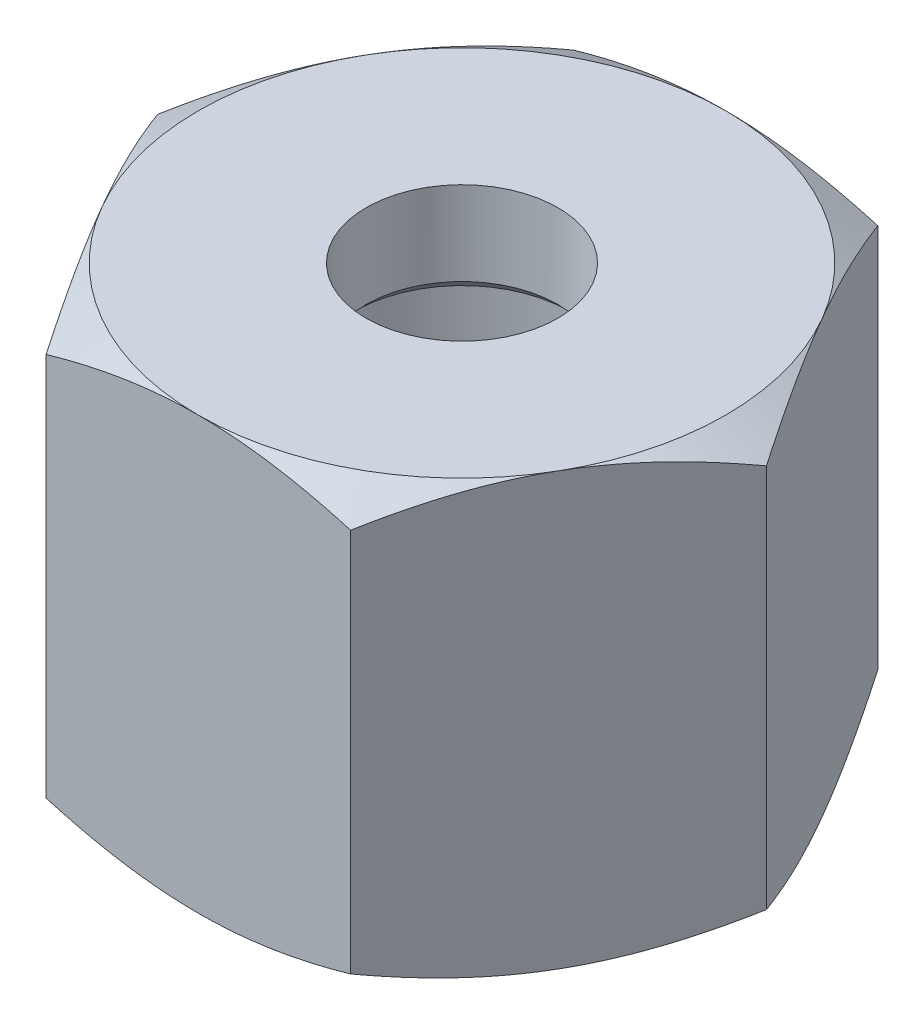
SolidWorks part; units mm, degrees
ref_plane "Přední rovina" through (0, 0, 0) normal (0, 0, 1) x (1, 0, 0)
ref_plane "Horní rovina" through (0, 0, 0) normal (0, 1, 0) x (1, 0, 0)
ref_plane "Pravá rovina" through (0, 0, 0) normal (1, 0, 0) x (0, 0, -1)
sketch "Skica1" plane through (0, 0, 0) normal (0, 1, 0) x (1, 0, 0)
  line L1 (12.7017, 0) -> (6.3509, 11)
  line L2 (6.3509, 11) -> (-6.3509, 11)
  line L3 (-6.3509, 11) -> (-12.7017, 0)
  line L4 (-12.7017, 0) -> (-6.3509, -11)
  line L5 (-6.3509, -11) -> (6.3509, -11)
  line L6 (6.3509, -11) -> (12.7017, 0)
  circle A0 centre (0, 0) radius 11 construction
extrude "Přidat vysunutím1" add sketch "Skica1" along normal blind 18
sketch "Skica2" plane through (0, 18, 0) normal (0, 1, 0) x (1, 0, 0)
  circle A0 centre (0, 0) radius 11
extrude "Odebrat vysunutím1" cut sketch "Skica2" against normal blind 1 draft 60 flip side to cut
sketch "Skica3" plane through (0, 0, 0) normal (0, -1, 0) x (1, 0, 0)
  circle A0 centre (0, 0) radius 11
extrude "Odebrat vysunutím2" cut sketch "Skica3" against normal blind 1 draft 60 flip side to cut
sketch "Skica4" plane through (0, 0, 0) normal (0, -1, 0) x (1, 0, 0)
  circle A0 centre (0, 0) radius 7.75
extrude "Odebrat vysunutím3" cut sketch "Skica4" against normal blind 14
chamfer "Zkosení2" distance 0.35 angle 45 1 edges at (0, 0, -7.75)
sketch "Skica5" plane through (0, 18, 0) normal (0, 1, 0) x (1, 0, 0)
  circle A0 centre (0, 0) radius 4
extrude "Odebrat vysunutím4" cut sketch "Skica5" against normal up to next
chamfer "Zkosení3" distance 0.5 angle 45 1 edges at (0, 14, -4)
